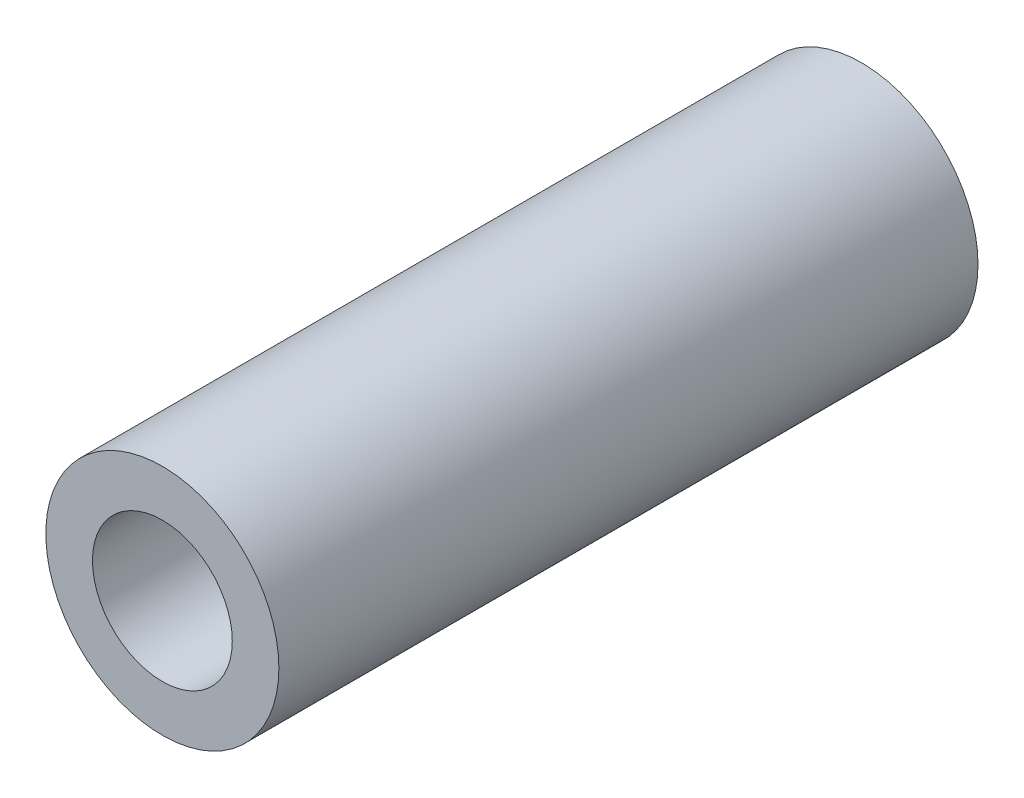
SolidWorks part; units mm, degrees
ref_plane "Ebene vorne" through (0, 0, 0) normal (0, 0, 1) x (1, 0, 0)
ref_plane "Ebene oben" through (0, 0, 0) normal (0, 1, 0) x (1, 0, 0)
ref_plane "Ebene rechts" through (0, 0, 0) normal (1, 0, 0) x (0, 0, -1)
sketch "Skizze1" plane through (0, 0, 0) normal (0, 0, 1) x (1, 0, 0)
  circle A0 centre (0, 0) radius 15
  circle A1 centre (0, 0) radius 25
  dimension "D1" = 30
  dimension "D2" = 50
extrude "Aufsatz-Linear austragen1" add sketch "Skizze1" along normal blind 150
sketch "Skizze2" plane through (0, 0, 0) normal (0, 0, -1) x (-1, 0, 0)
  circle A0 centre (0, 0) radius 15 construction
  circle A1 centre (0, 0) radius 15
extrude "Aufsatz-Linear austragen2" add sketch "Skizze2" against normal blind 50
